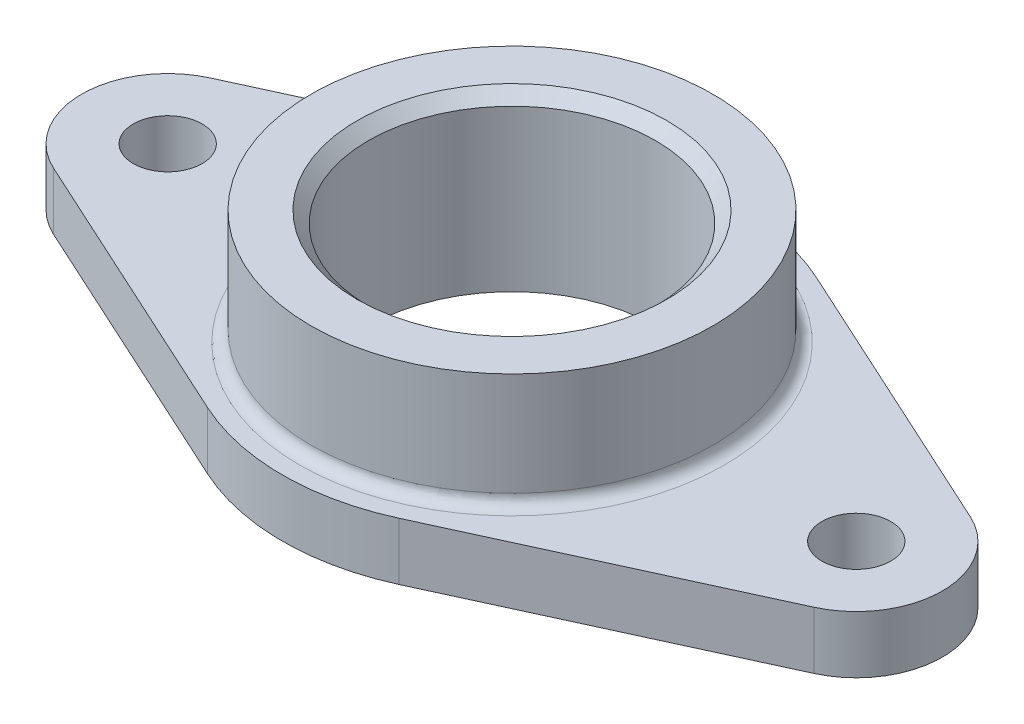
SolidWorks part; units mm, degrees
ref_plane "正面" through (0, 0, 0) normal (0, 0, 1) x (1, 0, 0)
ref_plane "平面" through (0, 0, 0) normal (0, 1, 0) x (1, 0, 0)
ref_plane "右側面" through (0, 0, 0) normal (1, 0, 0) x (0, 0, -1)
sketch "layout" plane through (0, 0, 0) normal (0, 1, 0) x (1, 0, 0)
  line L0 (-60, 0) -> (60, 0) construction
  circle A0 centre (0, 0) radius 40
  circle A1 centre (-60, 0) radius 15
  circle A2 centre (60, 0) radius 15
  dimension "D1" = 30
  dimension "D3" = 80
  dimension "D2" = 120
sketch "ｽｹｯﾁ2" plane through (0, 0, 0) normal (0, 1, 0) x (1, 0, 0)
  line L0 (-66.25, 13.6359) -> (-16.6667, 36.3624)
  line L1 (-66.25, -13.6359) -> (-16.6667, -36.3624)
  line L2 (16.6667, 36.3624) -> (66.25, 13.6359)
  line L3 (16.6667, -36.3624) -> (66.25, -13.6359)
  circle A0 centre (-60, 0) radius 15 construction
  circle A1 centre (0, 0) radius 40 construction
  circle A2 centre (60, 0) radius 15 construction
  arc A3 (-16.6667, -36.3624) -> (16.6667, -36.3624) centre (0, 0) ccw
  arc A4 (66.25, -13.6359) -> (66.25, 13.6359) centre (60, 0) ccw
  arc A5 (-66.25, 13.6359) -> (-66.25, -13.6359) centre (-60, 0) ccw
  arc A6 (16.6667, 36.3624) -> (-16.6667, 36.3624) centre (0, 0) ccw
extrude "押し出し1" add sketch "ｽｹｯﾁ2" along normal blind 10
sketch "ｽｹｯﾁ3" plane through (0, 0, 0) normal (0, 1, 0) x (1, 0, 0)
  line L0 (-60, 0) -> (60, 0) construction
  circle A0 centre (0, 0) radius 35
  dimension "D1" = 70
extrude "押し出し2" add sketch "ｽｹｯﾁ3" along normal blind 30
sketch "ｽｹｯﾁ4" plane through (0, 0, 0) normal (0, 1, 0) x (1, 0, 0)
  circle A0 centre (0, 0) radius 25
  dimension "D1" = 50
extrude "ｶｯﾄ - 押し出し1" cut sketch "ｽｹｯﾁ4" along normal through all
sketch "ｽｹｯﾁ5" plane through (0, 0, 0) normal (0, 1, 0) x (1, 0, 0)
  circle A0 centre (-60, 0) radius 6
  circle A1 centre (60, 0) radius 6
  dimension "D1" = 12
extrude "ｶｯﾄ - 押し出し2" cut sketch "ｽｹｯﾁ5" along normal through all
chamfer "面取り1" distance 2 angle 45 1 edges at (0, 30, 25)
fillet "ﾌｨﾚｯﾄ1" radius 2 1 edges at (0, 10, 35)
